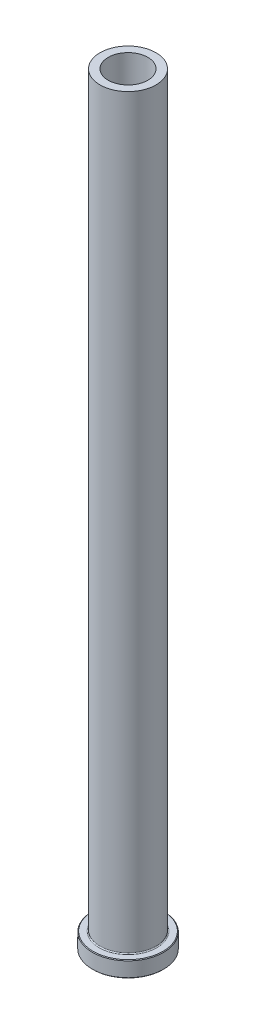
SolidWorks part; units mm, degrees
ref_plane "Front Plane" through (0, 0, 0) normal (0, 0, 1) x (1, 0, 0)
ref_plane "Top Plane" through (0, 0, 0) normal (0, 1, 0) x (1, 0, 0)
ref_plane "Right Plane" through (0, 0, 0) normal (1, 0, 0) x (0, 0, -1)
sketch "Sketch1" plane through (0, 0, 0) normal (0, 0, 1) x (1, 0, 0)
  line L0 (0, 0) -> (0, 50000) construction
  line L1 (0, 0) -> (14.224, 0)
  line L2 (14.224, 0) -> (14.224, 6.35)
  line L3 (14.224, 6.35) -> (11.5665, 6.35)
  line L4 (11.1696, 6.7469) -> (11.1696, 304.8)
  line L5 (11.1696, 304.8) -> (0, 304.8)
  line L6 (0, 304.8) -> (0, 0)
  arc A0 (11.1696, 6.7469) -> (11.5665, 6.35) centre (11.5665, 6.7469) ccw
  dimension "D5" = 0.3969
  dimension "D1" = 22.3393
  dimension "D2" = 28.448
  dimension "D3" = 6.35
  dimension "D4" = 304.8
revolve "Revolve1" add sketch "Sketch1" angle 360 about L0
sketch "Sketch2" plane through (0, 0, 0) normal (0, 0, 1) x (1, 0, 0)
  line L0 (0, 0) -> (0, 50000) construction
  line L1 (-14.224, 0) -> (14.224, 0) construction
  line L2 (8.5249, 0) -> (8.128, 0.3969)
  line L3 (8.128, 0.3969) -> (8.128, 230.3145)
  line L4 (8.128, 230.3145) -> (7.9375, 244.602)
  line L5 (7.9375, 244.602) -> (7.9375, 304.8)
  line L6 (11.1696, 304.8) -> (-11.1696, 304.8) construction
  line L7 (7.9375, 304.8) -> (0, 304.8)
  line L8 (0, 304.8) -> (0, 0)
  line L9 (0, 0) -> (8.5249, 0)
  point P4 (0, 0)
  dimension "D1" = 0.3969
  dimension "D2" = 45
  dimension "D3" = 15.875
  dimension "D4" = 16.256
  dimension "D5" = 60.198
  dimension "D6" = 14.2875
revolve "Cut-Revolve1" cut sketch "Sketch2" angle 360 about L0
chamfer "Chamfer1" distance 0.254 angle 45 2 edges at (0, 0, -14.224) (0, 6.35, -14.224)
